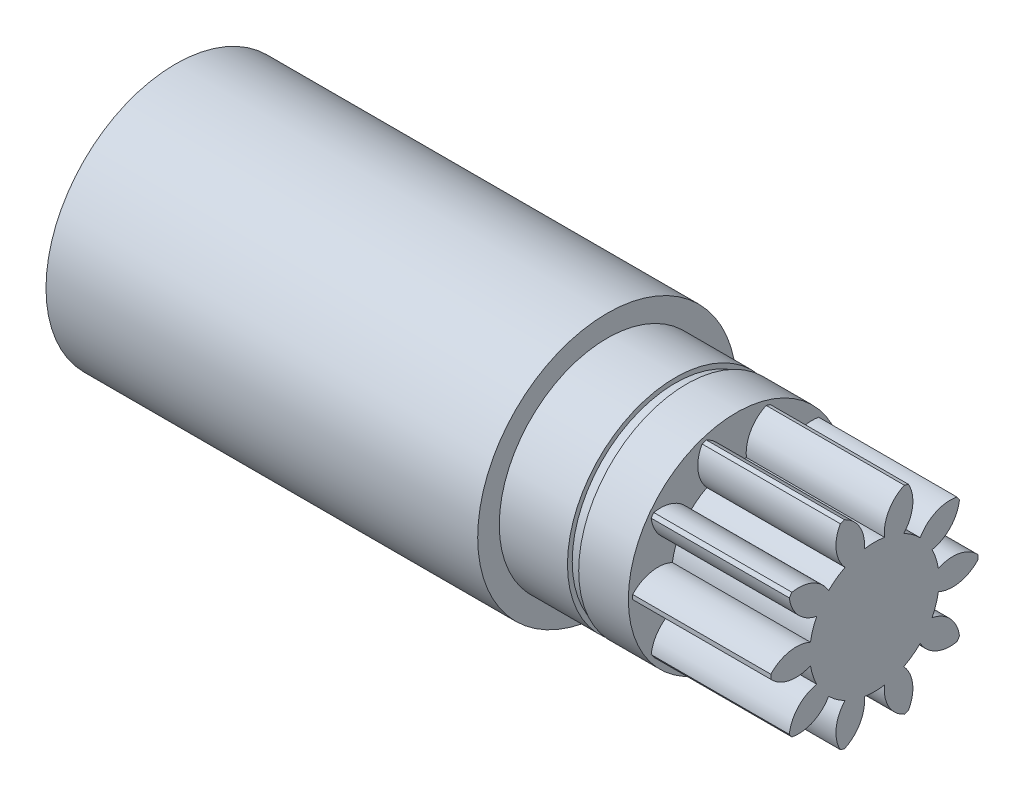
SolidWorks part; units mm, degrees
ref_plane "Plane1" through (0, 0, 0) normal (0, 0, 1) x (1, 0, 0)
ref_plane "Plane2" through (0, 0, 0) normal (0, 1, 0) x (1, 0, 0)
ref_plane "Plane3" through (0, 0, 0) normal (1, 0, 0) x (0, 0, -1)
sketch "HoldingSke" plane through (0, 0, 0) normal (0, 1, 0) x (1, 0, 0)
  line L0 (0, 0) -> (0.4924, -0.0868)
  line L1 (-15, 0) -> (100, 0) construction
  line L2 (0, 0) -> (-2.1039, 2.3779)
  line L3 (0, 0) -> (-11.863, 4.5341)
  line L4 (0, 0) -> (8.5048, 1.4996)
  line L5 (0, 0) -> (-46.8476, -17.4728)
  line L6 (0, 0) -> (-13.2634, -8.9489)
  line L7 (-2.1039, 2.3779) -> (8.6586, 51.2059)
  line L8 (-76.2, 54.61) -> (-73.9, 54.61)
  line L9 (-71.009, 38.7566) -> (-53.1078, 45.2721)
  line L10 (-76.2, 71.12) -> (104.1128, 71.12)
  line L11 (0, 0) -> (-16, 0)
  line L12 (-76.2, 101.6) -> (-76.133, 101.6)
  line L13 (24.9733, 27.94) -> (52.9518, 28.4284)
  line L14 (24.9733, 27.94) -> (24.9743, 27.94)
  line L15 (24.9733, 27.94) -> (100.4006, 29.5858)
  line L16 (-63.627, -2) -> (-12.827, -2)
  circle A0 centre (0, 0) radius 8
  circle A1 centre (0, 0) radius 7.499
  circle A2 centre (0, 0) radius 37.5
  circle A3 centre (0, 0) radius 7.4736
  dimension "MHD" = 14.998
  dimension "Hub_dia" = 75
  dimension "Bore" = 16
  dimension "MBD" = 14.9472
  dimension "Num_teeth" = 10
  dimension "Pitch_radius" = 180.3128
  dimension "Pitch" = 0.5
  dimension "Width" = 16
  dimension "Overall_len" = 50
  dimension "Show_teeth" = 10
  dimension "Thickness" = 16
  dimension "OAL" = 50.0001
  dimension "T_dim" = 2.3
  dimension "Ap" = 20
  dimension "H" = 19.05
  dimension "Backlash" = 0.067
  dimension "Addendum_fac" = 1
  dimension "Dedendum_fac" = 1.25
  dimension "Clearance_fac" = 0.25
  dimension "Dedendum_add" = 0.001
  dimension "Module" = 2
sketch "BasProSke" plane through (0, 0, 0) normal (0, 1, 0) x (1, 0, 0)
  line L0 (-10, 0) -> (60, 0) construction
  line L1 (0, 0) -> (0, 12)
  line L2 (0, 0) -> (16, 0)
  line L3 (16, 0) -> (16, 12)
  line L4 (16, 12) -> (0, 12)
  dimension "Diameter" = 24
  dimension "Thickness" = 16
revolve "Base-Revolve" add sketch "BasProSke" angle 360 about L0
sketch "TooCutSke" plane through (0, 0, 0) normal (1, 0, 0) x (0, 0, -1)
  line L1 (0, 0) -> (0, 107) construction
  line L2 (0, 0) -> (-1.6814, 9.8576) construction
  line L3 (0, 0) -> (-6.1153, 18.8209) construction
  line L4 (-1.6814, 9.8576) -> (-3.0576, 9.4105) construction
  arc A0 (1.1737, 7.4066) -> (-1.1737, 7.4066) centre (0, 0) ccw
  arc A1 (3.4979, 11.5054) -> (-3.4979, 11.5054) centre (0, 0) ccw
  circle A2 centre (0, 0) radius 10 construction
  circle A3 centre (0, 0) radius 9.3969 construction
  arc A4 (-1.1737, 7.4066) -> (-3.4979, 11.5054) centre (-5.1477, 7.8615) ccw
  arc A5 (3.4979, 11.5054) -> (1.1737, 7.4066) centre (5.1477, 7.8615) ccw
  dimension "Root_dia" = 14.998
  dimension "Overcut_dia" = 24.0508
  dimension "Pitch_dia" = 20
  dimension "Base_dia" = 18.7939
  dimension "Flank_rad" = 4
  dimension "Half_ang" = 18
  dimension "Half_CT" = 1.4471
extrude "ToothCut" cut sketch "TooCutSke" along normal through all
fillet "Breaks" radius 0.04
fillet "RootFillets" radius 0.501
pattern_circular "TeethCuts" count 10 every 36 about axis through (-10, 0, 0) along (1, 0, 0) of "ToothCut", "RootFillets", "Breaks"
sketch "HubNeaOneSke" plane through (0, 0, 0) normal (-1, 0, 0) x (0, 0, 1)
  circle A0 centre (0, 0) radius 7.499
  dimension "Diameter" = 14.998
extrude "HubNearOne" add sketch "HubNeaOneSke" along normal blind 34.0001
sketch "HubNeaBotSke" plane through (0, 0, 0) normal (-1, 0, 0) x (0, 0, 1)
  circle A0 centre (0, 0) radius 7.499
  dimension "Diameter" = 14.998
extrude "HubNearBoth" add sketch "HubNeaBotSke" along normal blind 17
ref_plane "FarPln" through (16, 0, 0) normal (1, 0, 0) x (0, 0, -1)
sketch "HubFarSke" plane through (16, 0, 0) normal (1, 0, 0) x (0, 0, -1)
  circle A0 centre (0, 0) radius 7.499
  dimension "Diameter" = 14.998
extrude "HubFar" add sketch "HubFarSke" along normal blind 17
sketch "BorSke" plane through (0, 0, 0) normal (1, 0, 0) x (0, 0, -1)
  circle A0 centre (0, 0) radius 7.4736
  dimension "Diameter" = 14.9472
extrude "Bore" cut sketch "BorSke" along normal mid plane 100.0001
sketch "KeySke" plane through (0, 0, 0) normal (1, 0, 0) x (0, 0, -1)
  line L0 (-2.5, 0) -> (-2.5, 9.7736)
  line L1 (-2.5, 9.7736) -> (2.5, 9.7736)
  line L2 (2.5, 9.7736) -> (2.5, 0)
  line L3 (0, 0) -> (0, 34) construction
  line L4 (-2.5, 0) -> (2.5, 0)
  dimension "Offset" = 9.7736
  dimension "Width" = 5
extrude "Keyway" cut sketch "KeySke" along normal mid plane 100.0001
pattern_circular "Keyway2" count 2 every 90 about axis through (-10, 0, 0) along (1, 0, 0)
sketch "Esquisse1" plane through (16, 0, 0) normal (1, 0, 0) x (0, 0, -1)
  circle A0 centre (0, 0) radius 7.499
  arc A1 (3.404, -6.6819) -> (5.303, -5.3022) centre (0, 0) ccw construction
extrude "Extrusion2" add sketch "Esquisse1" against normal blind 16
sketch "Esquisse2" plane through (0, 0, 0) normal (-1, 0, 0) x (0, 0, 1)
  circle A0 centre (0, 0) radius 12.5
  dimension "D1" = 25
extrude "Extrusion3" add sketch "Esquisse2" along normal blind 5.75
sketch "Esquisse3" plane through (-5.75, 0, 0) normal (-1, 0, 0) x (0, 0, 1)
  circle A0 centre (0, 0) radius 11.95
  dimension "D1" = 23.9
extrude "Extrusion4" add sketch "Esquisse3" along normal blind 1.3
sketch "Esquisse4" plane through (-7.05, 0, 0) normal (-1, 0, 0) x (0, 0, 1)
  circle A0 centre (0, 0) radius 12.5
  dimension "D1" = 25
extrude "Extrusion5" add sketch "Esquisse4" along normal blind 7.9
sketch "Esquisse5" plane through (-14.95, 0, 0) normal (-1, 0, 0) x (0, 0, 1)
  circle A0 centre (0, 0) radius 15
  dimension "D1" = 30
extrude "Extrusion6" add sketch "Esquisse5" along normal blind 50
equation "' \"Module@HoldingSke\" = 6.35"
equation "' \"Num_teeth@HoldingSke\" = 12"
equation "' \"Ap@HoldingSke\" =  20"
equation "' \"Width@HoldingSke\" = 0.5 * 25.4"
equation "' \"Hub_dia@HoldingSke\"= 1 * 25.4"
equation "' \"Overall_len@HoldingSke\" = 1.0 * 25.4"
equation "' \"Bore@HoldingSke\" = 0.75 * 25.4"
equation "' \"T_dim@HoldingSke\" = 0.1 * 25.4"
equation "' \"Width@KeySke\" = 0.25 * 25.4"
equation "' \"Show_teeth@HoldingSke\" = 13"
equation "' \"Backlash@HoldingSke\" = 0.009 * 25.4"
equation "' \"Addendum_fac@HoldingSke\" = 1.0"
equation "' \"Dedendum_fac@HoldingSke\" = 1.25"
equation "' \"Dedendum_add@HoldingSke\" = 0.00005 * 25.4"
equation "' \"Clearance_fac@HoldingSke\" = 0.25"
equation "\"Pitch@HoldingSke\" = 1 / \"Module@HoldingSke\""
equation "\"Overcut_dia@TooCutSke\" = (\"Num_teeth@HoldingSke\" + 2 * \"Addendum_fac@HoldingSke\") / \"Pitch@HoldingSke\" + 0.002 * 25.4"
equation "\"Pitch_dia@TooCutSke\" = \"Num_teeth@HoldingSke\" / \"Pitch@HoldingSke\""
equation "\"Base_dia@TooCutSke\" = \"Num_teeth@HoldingSke\" / \"Pitch@HoldingSke\" * cos((\"Ap@HoldingSke\"  * 3.14159265 / 180))"
equation "\"Root_dia@TooCutSke\" = (\"Num_teeth@HoldingSke\" + 2) / \"Pitch@HoldingSke\" - 2 * (\"Addendum_fac@HoldingSke\" + \"Dedendum_fac@HoldingSke\") / \"Pitch@HoldingSke\" - \"Dedendum_add@HoldingSke\" * 2"
equation "\"Half_ang@TooCutSke\" = 180 / \"Num_teeth@HoldingSke\""
equation "\"Half_CT@TooCutSke\" = \"Num_teeth@HoldingSke\" / \"Pitch@HoldingSke\" * sin((3.14159265 / 2 / \"Num_teeth@HoldingSke\")) / 2 - 7 * \"Backlash@HoldingSke\" / 4"
equation "\"Flank_rad@TooCutSke\" = \"Num_teeth@HoldingSke\" / \"Pitch@HoldingSke\" / 5"
equation "\"Radius@RootFillets\" = \"Clearance_fac@HoldingSke\" / \"Pitch@HoldingSke\" + \"Dedendum_add@HoldingSke\""
equation "\"Break_rad@Breaks\" = 0.02 / \"Pitch@HoldingSke\""
equation "\"Thickness@HoldingSke\" = \"Width@HoldingSke\""
equation "\"OAL@HoldingSke\" = \"Thickness@HoldingSke\""
equation "\"MHD@HoldingSke\" = (\"Num_teeth@HoldingSke\" + 2) / \"Pitch@HoldingSke\" - 2 * (\"Addendum_fac@HoldingSke\" + \"Dedendum_fac@HoldingSke\")  / \"Pitch@HoldingSke\" - \"Dedendum_add@HoldingSke\" * 2"
equation "\"MBD@HoldingSke\" = (\"Num_teeth@HoldingSke\" + 2) / \"Pitch@HoldingSke\" - 2 * (\"Addendum_fac@HoldingSke\" + \"Dedendum_fac@HoldingSke\")  / \"Pitch@HoldingSke\" - \"Dedendum_add@HoldingSke\" * 2 - 0.002 * 25.4"
equation "\"MHD@HoldingSke\" = ((sgn( \"MHD@HoldingSke\" - \"Hub_dia@HoldingSke\" )-1)*( \"MHD@HoldingSke\" - \"Hub_dia@HoldingSke\" ))/-2+ \"Hub_dia@HoldingSke\""
equation "\"MBD@HoldingSke\" = ((sgn( \"MBD@HoldingSke\" - \"Bore@HoldingSke\" )-1)*( \"MBD@HoldingSke\" - \"Bore@HoldingSke\" ))/-2+ \"Bore@HoldingSke\""
equation "\"OAL@HoldingSke\" = ((sgn( \"OAL@HoldingSke\" - \"Overall_len@HoldingSke\" )+1)*( \"OAL@HoldingSke\" - \"Overall_len@HoldingSke\" ))/2 + \"Overall_len@HoldingSke\" + 0.000002 * 25.4"
equation "\"Num_teeth@TeethCuts\" = int( \"Show_teeth@HoldingSke\" ) + 1"
equation "\"Num_teeth@TeethCuts\" = ((sgn( \"Num_teeth@TeethCuts\" - \"Num_teeth@HoldingSke\" )-1)*( \"Num_teeth@TeethCuts\" - \"Num_teeth@HoldingSke\" ))/-2+ \"Num_teeth@HoldingSke\""
equation "\"Num_teeth@TeethCuts\" = ((sgn( \"Num_teeth@TeethCuts\" - 2.0)+1)*( \"Num_teeth@TeethCuts\" - 2.0))/2 +2.0"
equation "\"Angle@TeethCuts\" = 360.0 / \"Num_teeth@HoldingSke\""
equation "\"Diameter@BasProSke\" = (\"Num_teeth@HoldingSke\" + 2 * \"Addendum_fac@HoldingSke\") / \"Pitch@HoldingSke\""
equation "\"Thickness@BasProSke\"  = \"Thickness@HoldingSke\""
equation "' \"Fillet_rad@BasProSke\" =  \"Thickness@HoldingSke\" * 0.05"
equation "\"MHD@HoldingSke\" = ((sgn( \"MHD@HoldingSke\" - \"Root_dia@TooCutSke\" )-1)*( \"MHD@HoldingSke\" - \"Root_dia@TooCutSke\" ))/-2+ \"Root_dia@TooCutSke\""
equation "\"Diameter@HubNeaOneSke\" = \"MHD@HoldingSke\""
equation "\"Length@HubNearOne\" = \"OAL@HoldingSke\" - \"Thickness@BasProSke\""
equation "\"Diameter@HubNeaBotSke\" = \"MHD@HoldingSke\""
equation "\"Length@HubNearBoth\" = ( \"OAL@HoldingSke\" - \"Thickness@BasProSke\" ) / 2.0"
equation "\"Thickness@FarPln\" = \"Thickness@BasProSke\""
equation "\"Diameter@HubFarSke\" = \"MHD@HoldingSke\""
equation "\"Length@HubFar\" = ( \"OAL@HoldingSke\" - \"Thickness@BasProSke\" ) / 2.0"
equation "\"Diameter@BorSke\" = \"MBD@HoldingSke\""
equation "\"D1@Bore\" = \"OAL@HoldingSke\" * 2.0"
equation "\"D1@Keyway\" = \"OAL@HoldingSke\" * 2.0"
equation "\"Offset@KeySke\" = \"T_dim@HoldingSke\" + \"MBD@HoldingSke\" / 2.0"
